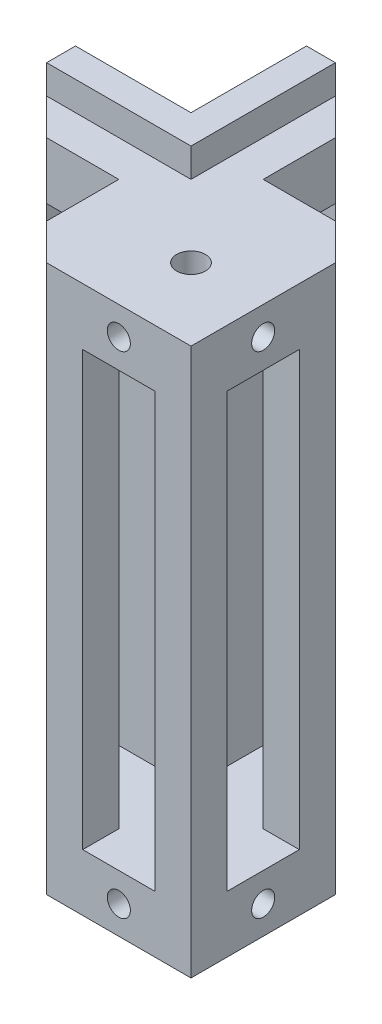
SolidWorks part; units mm, degrees
ref_plane "Front Plane" through (0, 0, 0) normal (0, 0, 1) x (1, 0, 0)
ref_plane "Top Plane" through (0, 0, 0) normal (0, 1, 0) x (1, 0, 0)
ref_plane "Right Plane" through (0, 0, 0) normal (1, 0, 0) x (0, 0, -1)
sketch "Sketch1" plane through (0, 0, 0) normal (0, 1, 0) x (1, 0, 0)
  line L0 (0, 0) -> (20, 0)
  line L1 (20, 0) -> (20, 20)
  line L2 (20, 20) -> (10, 20)
  line L3 (10, 20) -> (10, 10)
  line L4 (10, 10) -> (0, 10)
  line L5 (0, 10) -> (0, 0)
  line L6 (10, 10) -> (20, 0) construction
  line L7 (15, 5) -> (0, 5) construction
  line L8 (5, 10) -> (5, 0) construction
  line L9 (10, 15) -> (20, 15) construction
  line L11 (2.5, 7.5) -> (7.5, 7.5)
  line L12 (2.5, 7.5) -> (2.5, 2.5)
  line L13 (2.5, 2.5) -> (7.5, 2.5)
  line L14 (7.5, 7.5) -> (7.5, 2.5)
  line L15 (12.5, 17.5) -> (17.5, 17.5)
  line L16 (12.5, 17.5) -> (12.5, 12.5)
  line L17 (12.5, 12.5) -> (17.5, 12.5)
  line L18 (17.5, 17.5) -> (17.5, 12.5)
  circle A0 centre (15, 5) radius 1
  point P22 (5, 7.5)
  point P24 (2.5, 5)
  point P25 (15, 17.5)
  point P26 (15, 20)
  point P27 (12.5, 15)
  dimension "D5" = 2
  dimension "D1" = 10
  dimension "D2" = 10
  dimension "D3" = 20
  dimension "D4" = 20
  dimension "D6" = 5
  dimension "D7" = 5
  dimension "D8" = 5
  dimension "D9" = 5
extrude "Boss-Extrude1" add sketch "Sketch1" against normal blind 37.9
sketch "Sketch2" plane through (0, 0, 0) normal (0, 0, 1) x (1, 0, 0)
  line L0 (15, -37.9) -> (15, 0) construction
  line L1 (0, -37.9) -> (20, -37.9) construction
  line L2 (0, 0) -> (20, 0) construction
  line L3 (20, -37.9) -> (20, 0) construction
  circle A0 centre (15, -1.95) radius 0.8
  circle A1 centre (15, -5.95) radius 0.8
  circle A2 centre (15, -31.95) radius 0.8
  circle A3 centre (15, -35.95) radius 0.8
  point P16 (15, -18.95)
  dimension "D2" = 1.6
  dimension "D3" = 1.6
  dimension "D4" = 1.6
  dimension "D5" = 1.6
  dimension "D1" = 5
  dimension "D6" = 4
  dimension "D7" = 4
  dimension "D8" = 26
  dimension "D9" = 13
extrude "Boss-Extrude2" add sketch "Sketch2" against normal blind 3
sketch "Sketch3" plane through (20, 0, 0) normal (1, 0, 0) x (0, 0, -1)
  line L0 (5, 0) -> (5, -37.9) construction
  line L1 (0, 0) -> (20, 0) construction
  line L2 (0, -37.9) -> (20, -37.9) construction
  line L3 (0, -37.9) -> (0, 0) construction
  circle A0 centre (5, -1.95) radius 0.8
  circle A1 centre (5, -5.95) radius 0.8
  circle A2 centre (5, -31.95) radius 0.8
  circle A3 centre (5, -35.95) radius 0.8
  point P18 (5, -18.95)
  dimension "D2" = 1.6
  dimension "D3" = 1.6
  dimension "D4" = 1.6
  dimension "D5" = 1.6
  dimension "D1" = 5
  dimension "D6" = 4
  dimension "D7" = 4
  dimension "D8" = 26
  dimension "D9" = 13
extrude "Boss-Extrude3" add sketch "Sketch3" against normal blind 3
sketch "Sketch4" plane through (0, 0, 0) normal (0, 1, 0) x (1, 0, 0)
  line L0 (0, 10) -> (0, 12)
  line L1 (0, 12) -> (8, 12)
  line L2 (10, 20) -> (8, 20)
  line L3 (8, 20) -> (8, 12)
  line L4 (0, 10) -> (10, 10)
  line L5 (10, 10) -> (10, 20)
  dimension "D1" = 2
  dimension "D2" = 2
extrude "Boss-Extrude4" add sketch "Sketch4" along normal blind 2 and the other way blind 39.9
sketch "Sketch5" plane through (0, 0, 0) normal (0, 0, 1) x (1, 0, 0)
  line L0 (5, -37.9) -> (5, 0) construction
  line L1 (10, -37.9) -> (0, -37.9) construction
  line L2 (10, 0) -> (0, 0) construction
  line L4 (2.5, -3.95) -> (7.5, -3.95)
  line L5 (2.5, -3.95) -> (2.5, -33.95)
  line L6 (2.5, -33.95) -> (7.5, -33.95)
  line L7 (7.5, -3.95) -> (7.5, -33.95)
  point P11 (5, -3.95)
  point P12 (5, -18.95)
  point P13 (2.5, -18.95)
  dimension "D1" = 5
  dimension "D2" = 30
extrude "Cut-Extrude1" cut sketch "Sketch5" against normal through all
sketch "Sketch6" plane through (20, 0, 0) normal (1, 0, 0) x (0, 0, -1)
  line L0 (15, -37.9) -> (15, 0) construction
  line L1 (20, -37.9) -> (10, -37.9) construction
  line L2 (0, 0) -> (20, 0) construction
  line L4 (12.5, -3.95) -> (17.5, -3.95)
  line L5 (12.5, -3.95) -> (12.5, -33.95)
  line L6 (12.5, -33.95) -> (17.5, -33.95)
  line L7 (17.5, -3.95) -> (17.5, -33.95)
  point P10 (15, -3.95)
  point P11 (15, -18.95)
  point P12 (17.5, -18.95)
  dimension "D1" = 5
  dimension "D2" = 30
extrude "Cut-Extrude2" cut sketch "Sketch6" against normal through all
sketch "Sketch7" plane through (0, 0, -20) normal (0, 0, -1) x (-1, 0, 0)
  line L0 (-15, 0) -> (-15, -37.9) construction
  line L1 (-20, 0) -> (-10, 0) construction
  line L2 (-20, -37.9) -> (-10, -37.9) construction
  line L4 (-17.5, -3.95) -> (-12.5, -3.95)
  line L5 (-17.5, -3.95) -> (-17.5, -33.95)
  line L6 (-17.5, -33.95) -> (-12.5, -33.95)
  line L7 (-12.5, -3.95) -> (-12.5, -33.95)
  point P10 (-15, -3.95)
  point P11 (-17.5, -18.95)
  point P12 (-15, -18.95)
  dimension "D1" = 5
  dimension "D2" = 30
extrude "Cut-Extrude3" cut sketch "Sketch7" against normal through all
sketch "Sketch8" plane through (0, 0, 0) normal (-1, 0, 0) x (0, 0, 1)
  line L0 (-5, -37.9) -> (-5, 0) construction
  line L1 (-10, -37.9) -> (0, -37.9) construction
  line L2 (-10, 0) -> (0, 0) construction
  line L4 (-7.5, -3.95) -> (-2.5, -3.95)
  line L5 (-7.5, -3.95) -> (-7.5, -33.95)
  line L6 (-7.5, -33.95) -> (-2.5, -33.95)
  line L7 (-2.5, -3.95) -> (-2.5, -33.95)
  point P10 (-5, -3.95)
  point P11 (-5, -18.95)
  point P12 (-7.5, -18.95)
  dimension "D1" = 5
  dimension "D2" = 30
extrude "Cut-Extrude4" cut sketch "Sketch8" against normal through all
sketch "Sketch9" plane through (0, 0, 0) normal (0, 0, 1) x (1, 0, 0)
  line L0 (10, 0) -> (20, 0) construction
  line L1 (0, 0) -> (20, 0) construction
  line L2 (15, 0) -> (15, -37.9) construction
  line L3 (0, -37.9) -> (20, -37.9) construction
  circle A0 centre (15, -1.95) radius 0.8
  circle A1 centre (15, -35.95) radius 0.8
  point P13 (15, -18.95)
  dimension "D1" = 1.6
  dimension "D2" = 1.6
  dimension "D3" = 34
  dimension "D4" = 17
extrude "Cut-Extrude6" cut sketch "Sketch9" against normal blind 3
sketch "Sketch11" plane through (0, 0, 0) normal (0, 1, 0) x (1, 0, 0)
  line L0 (10, 10) -> (10, 0) construction
  line L1 (0, 0) -> (20, 0) construction
  line L2 (10, 10) -> (20, 10) construction
  line L3 (20, 0) -> (20, 20) construction
  line L4 (0, 10) -> (10, 0)
  line L5 (10, 0) -> (0, 0)
  line L6 (0, 0) -> (0, 10)
  line L7 (20, 10) -> (20, 20)
  line L8 (20, 20) -> (10, 20)
  line L9 (10, 20) -> (20, 10)
extrude "Cut-Extrude7" cut sketch "Sketch11" against normal through all
sketch "Sketch12" plane through (20, 0, 0) normal (1, 0, 0) x (0, 0, -1)
  line L0 (5, 0) -> (5, -37.9) construction
  line L1 (0, 0) -> (10, 0) construction
  line L2 (0, -37.9) -> (10, -37.9) construction
  circle A0 centre (5, -1.95) radius 0.8
  circle A1 centre (5, -35.95) radius 0.8
  point P10 (5, -18.95)
  dimension "D1" = 1.6
  dimension "D2" = 1.6
  dimension "D3" = 34
  dimension "D4" = 17
extrude "Cut-Extrude8" cut sketch "Sketch12" against normal blind 3
